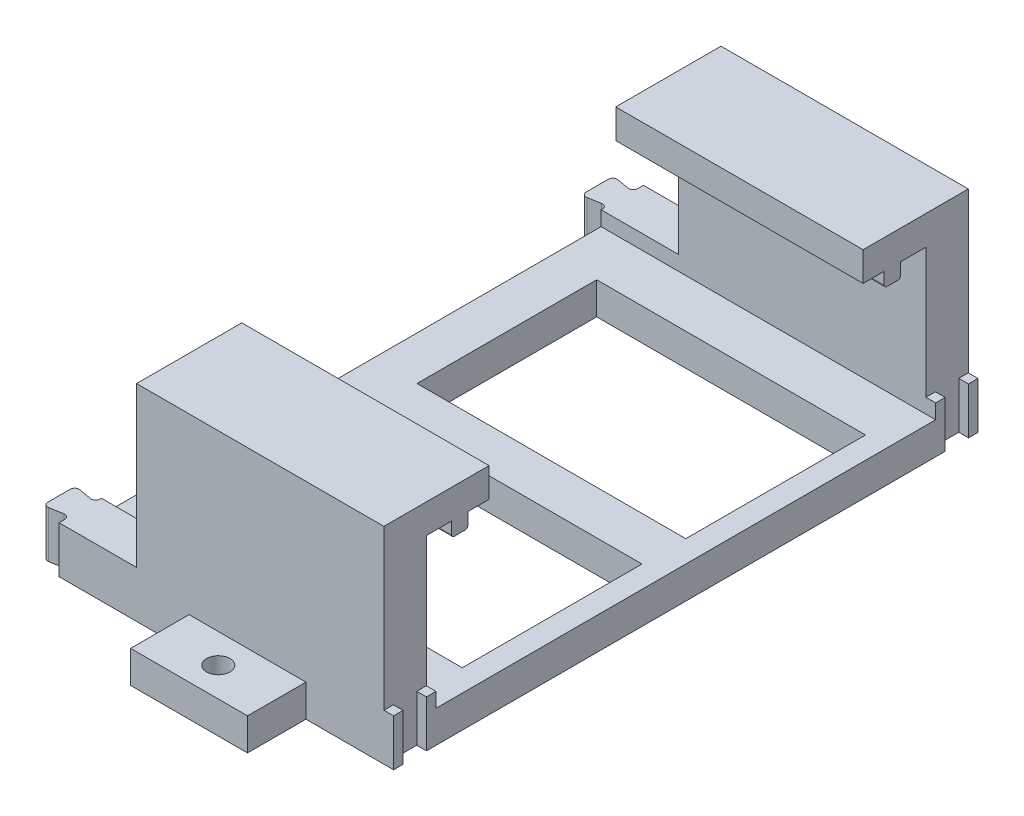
SolidWorks part; units mm, degrees
ref_plane "Front Plane" through (0, 0, 0) normal (0, 0, 1) x (1, 0, 0)
ref_plane "Top Plane" through (0, 0, 0) normal (0, 1, 0) x (1, 0, 0)
ref_plane "Right Plane" through (0, 0, 0) normal (1, 0, 0) x (0, 0, -1)
sketch "Sketch1" plane through (0, 0, 0) normal (0, 1, 0) x (1, 0, 0)
  line L1 (-184.5, -100) -> (184.5, -100)
  line L2 (-184.5, -100) -> (-184.5, 100)
  line L3 (-184.5, 100) -> (184.5, 100)
  line L4 (184.5, -100) -> (184.5, 100)
  line L5 (-184.5, -100) -> (184.5, 100) construction
  line L6 (-184.5, 100) -> (184.5, -100) construction
  point P0 (0, 0)
  dimension "D1" = 200
  dimension "353" = 369
extrude "Boss-Extrude1" add sketch "Sketch1" along normal blind 16
sketch "Sketch2" plane through (0, 16, 0) normal (0, 1, 0) x (1, 0, 0)
  line L0 (-184.5, -100) -> (184.5, -100) construction
  line L1 (-184.5, -100) -> (-155.6166, -100)
  line L2 (-184.5, -100) -> (-184.5, -36.5)
  line L3 (-184.5, -36.5) -> (-169.5, -36.5)
  line L4 (-169.5, -84) -> (-169.5, -36.5)
  line L5 (-184.5, 100) -> (-155.6166, 100)
  line L6 (-184.5, 100) -> (-184.5, 36.5)
  line L7 (-184.5, 36.5) -> (-169.5, 36.5)
  line L8 (-169.5, 84) -> (-169.5, 36.5)
  line L9 (-155.6166, 100) -> (-119.5, 100)
  line L11 (-169.5, 84) -> (-119.5, 84)
  line L12 (-119.5, 100) -> (-119.5, 84)
  line L13 (-155.6166, -100) -> (-119.5, -100)
  line L15 (-169.5, -84) -> (-119.5, -84)
  line L16 (-119.5, -100) -> (-119.5, -84)
  line L17 (-44.5, -100) -> (84.5, -100)
  line L18 (-44.5, -100) -> (-44.5, -84)
  line L19 (-44.5, -84) -> (84.5, -84)
  line L20 (84.5, -100) -> (84.5, -84)
  line L22 (-44.5, 100) -> (84.5, 100)
  line L23 (-44.5, 100) -> (-44.5, 84)
  line L24 (-44.5, 84) -> (84.5, 84)
  line L25 (84.5, 100) -> (84.5, 84)
  line L26 (184.5, -100) -> (184.5, 100) construction
  line L27 (184.5, 100) -> (-184.5, 100) construction
  point P28 (84.5, -92)
  dimension "D1" = 65
  dimension "D2" = 15
  dimension "D3" = 65
  dimension "D4" = 15
  dimension "D5" = 16
  dimension "D6" = 50
  dimension "D7" = 50
  dimension "D8" = 16
  dimension "D9" = 75
  dimension "D10" = 100
extrude "Boss-Extrude2" add sketch "Sketch2" along normal blind 12
sketch "Sketch3" plane through (0, 16, 0) normal (0, 1, 0) x (1, 0, 0)
  line L0 (-119.5, -84) -> (-169.5, -84) construction
  line L1 (-169.5, 84) -> (172.5, 84)
  line L2 (-169.5, 84) -> (-169.5, -84)
  line L3 (-169.5, -84) -> (172.5, -84)
  line L4 (172.5, 84) -> (172.5, -84)
  dimension "D1" = 342
extrude "Cut-Extrude1" cut sketch "Sketch3" against normal blind 5
sketch "Sketch4" plane through (0, 0, -100) normal (0, 0, -1) x (-1, 0, 0)
  line L0 (-84.5, 28) -> (44.5, 28) construction
  line L1 (-69.5, 16) -> (30.5, 16)
  line L2 (-69.5, 16) -> (-69.5, 28)
  line L3 (-69.5, 28) -> (30.5, 28)
  line L4 (30.5, 16) -> (30.5, 28)
  line L5 (-69.5, 16) -> (30.5, 28) construction
  line L6 (-69.5, 28) -> (30.5, 16) construction
  line L8 (-84.5, 28) -> (-84.5, 16) construction
  point P0 (-19.5, 22)
  dimension "D1" = 100
  dimension "D2" = 15
extrude "Boss-Extrude3" add sketch "Sketch4" along normal blind 60
sketch "Sketch8" plane through (0, 28, 0) normal (0, 1, 0) x (1, 0, 0)
  line L0 (-184.5, 36.5) -> (-169.5, 36.5)
  line L1 (-169.5, 36.5) -> (-169.5, 84)
  line L2 (-169.5, 84) -> (-119.5, 84)
  line L3 (-119.5, 84) -> (-119.5, 100)
  line L4 (-119.5, 100) -> (-184.5, 100)
  line L5 (-184.5, 100) -> (-184.5, 36.5)
extrude "Boss-Extrude5" add sketch "Sketch8" along normal blind 42
sketch "Sketch9" plane through (0, 70, 0) normal (0, 1, 0) x (1, 0, 0)
  line L0 (-119.5, 84) -> (-119.5, 70)
  line L1 (-119.5, 70) -> (-155.5, 70)
  line L2 (-155.5, 70) -> (-155.5, 35)
  line L3 (-155.5, 35) -> (-169.5, 35)
  line L4 (-169.5, 36.5) -> (-169.5, 84) construction
  line L5 (-169.5, 84) -> (-169.5, -84) construction
  line L6 (172.5, 84) -> (-169.5, 84) construction
  dimension "D1" = 14
  dimension "D2" = 14
extrude "Extrude-Thin1" add sketch "Sketch9" against normal blind 7 thin
sketch "Sketch11" plane through (0, 70, 0) normal (0, 1, 0) x (1, 0, 0)
  line L1 (-184.5, 100) -> (-44.5, 100)
  line L2 (-184.5, 100) -> (-184.5, -100)
  line L3 (-184.5, -100) -> (-44.5, -100)
  line L4 (-44.5, 100) -> (-44.5, -100)
extrude "Cut-Extrude5" cut sketch "Sketch11" against normal through all
sketch "Sketch13" plane through (0, 28, 0) normal (0, 1, 0) x (1, 0, 0)
  line L0 (-44.5, 96.22) -> (-44.5, 87.78)
  line L1 (-44.5, 100) -> (-44.5, 84) construction
  line L2 (-44.5, 87.78) -> (-52.3, 86.4046)
  line L3 (-52.3, 86.4046) -> (-52.3, 97.5954)
  line L4 (-52.3, 97.5954) -> (-44.5, 96.22)
  line L5 (-44.5, -87.78) -> (-44.5, -96.22)
  line L6 (-44.5, -96.22) -> (-52.5, -97.6306)
  line L7 (-52.5, -97.6306) -> (-52.5, -86.3694)
  line L8 (-52.5, -86.3694) -> (-44.5, -87.78)
  line L9 (-44.5, -84) -> (-44.5, -100) construction
  dimension "D1" = 3.78
  dimension "D2" = 3.78
  dimension "D3" = 7.8
  dimension "D4" = 80
  dimension "D5" = 80
  dimension "D6" = 3.78
  dimension "D7" = 3.78
  dimension "D8" = 80
  dimension "D9" = 8
  dimension "D10" = 80
extrude "Boss-Extrude6" add sketch "Sketch13" against normal through all
fillet "Fillet1" radius 1.5 8 edges at (-44.5, 14, 87.78) (-52.5, 14, 86.3694) (-52.5, 14, 97.6306) (-44.5, 14, 96.22) (-44.5, 14, -96.22) (-44.5, 14, -87.78) (-52.3, 14, -86.4046) (-52.3, 14, -97.5954)
sketch "Sketch14" plane through (0, 0, 0) normal (0, 0, 1) x (1, 0, 0)
  line L0 (84.5, 16) -> (184.5, 16) construction
  line L1 (84.5, 28) -> (-67.1004, 28)
  line L2 (84.5, 28) -> (84.5, 16)
  line L3 (84.5, 16) -> (-67.1004, 16)
  line L4 (-67.1004, 28) -> (-67.1004, 16)
extrude "Cut-Extrude6" cut sketch "Sketch14" along normal through all and the other way through all
sketch "Sketch15" plane through (0, 16, 0) normal (0, 1, 0) x (1, 0, 0)
  line L0 (184.5, 100) -> (-44.5, 100) construction
  line L1 (-17.9669, 100) -> (79.8991, 100)
  line L2 (-17.9669, 100) -> (-17.9669, 84)
  line L3 (-17.9669, 84) -> (79.8991, 84)
  line L4 (79.8991, 100) -> (79.8991, 84)
  line L5 (172.5, 84) -> (-44.5, 84) construction
extrude "Boss-Extrude7" add sketch "Sketch15" along normal blind 62
sketch "Sketch16" plane through (0, 0, -84) normal (0, 0, 1) x (1, 0, 0)
  line L0 (79.8991, 78) -> (79.8991, 16) construction
  line L1 (-17.9669, 78) -> (79.8991, 78)
  line L2 (-17.9669, 78) -> (-17.9669, 60.5)
  line L3 (-17.9669, 60.5) -> (79.8991, 60.5)
  line L4 (79.8991, 78) -> (79.8991, 60.5)
  line L5 (172.5, 11) -> (-44.5, 11) construction
  dimension "D1" = 49.5
extrude "Boss-Extrude8" add sketch "Sketch16" along normal blind 20
sketch "Sketch17" plane through (0, 60.5, 0) normal (0, -1, 0) x (1, 0, 0)
  line L0 (-17.9669, -64) -> (-17.9669, -84) construction
  line L1 (-17.9669, -71.2) -> (79.8991, -71.2)
  line L2 (-17.9669, -71.2) -> (-17.9669, -76.85)
  line L3 (-17.9669, -76.85) -> (79.8991, -76.85)
  line L4 (79.8991, -71.2) -> (79.8991, -76.85)
  line L5 (79.8991, -64) -> (79.8991, -84) construction
  line L6 (-17.9669, -84) -> (79.8991, -84) construction
  dimension "D1" = 5.65
  dimension "D2" = 7.15
extrude "Boss-Extrude9" add sketch "Sketch17" along normal blind 5
fillet "Fillet3" radius 1 2 edges at (30.9661, 55.5, -76.85) (30.9661, 55.5, -71.2)
sketch "Sketch18" plane through (0, 16, 0) normal (0, 1, 0) x (1, 0, 0)
  line L0 (184.5, -100) -> (184.5, 100) construction
  line L1 (172.5, 84) -> (184.5, 84)
  line L2 (172.5, 84) -> (172.5, -84)
  line L3 (172.5, -84) -> (184.5, -84)
  line L4 (184.5, 84) -> (184.5, -84)
  line L5 (-44.5, -84) -> (172.5, -84) construction
extrude "Cut-Extrude7" cut sketch "Sketch18" against normal blind 5
sketch "Sketch19" plane through (0, 0, -100) normal (0, 0, -1) x (-1, 0, 0)
  line L1 (0, 0) -> (-40, 0)
  line L2 (0, 0) -> (0, 11)
  line L3 (0, 11) -> (-40, 11)
  line L4 (-40, 0) -> (-40, 11)
  line L5 (-184.5, 0) -> (-144.5, 0)
  line L6 (-184.5, 0) -> (-184.5, 11)
  line L7 (-184.5, 11) -> (-144.5, 11)
  line L8 (-144.5, 0) -> (-144.5, 11)
  dimension "D1" = 11
  dimension "D2" = 11
  dimension "D3" = 40
  dimension "D4" = 40
extrude "Boss-Extrude10" add sketch "Sketch19" along normal blind 20
sketch "Sketch20" plane through (0, 11, 0) normal (0, 1, 0) x (1, 0, 0)
  line L0 (40, 120) -> (40, 100) construction
  line L1 (0, 120) -> (40, 120) construction
  line L2 (144.5, 120) -> (184.5, 120) construction
  line L3 (184.5, 120) -> (184.5, 100) construction
  circle A0 centre (164.5, 110) radius 4
  circle A1 centre (20, 110) radius 4
  dimension "D1" = 20
  dimension "D2" = 10
  dimension "D3" = 10
  dimension "D4" = 20
extrude "Cut-Extrude8" cut sketch "Sketch20" against normal through all
mirror "Mirror3" about plane through (0, 0, 0) normal (0, 0, 1) of "Cut-Extrude8", "Boss-Extrude10", "Boss-Extrude9", "Boss-Extrude7", "Boss-Extrude8", "Fillet3"
sketch "Sketch21" plane through (0, 11, 0) normal (0, 1, 0) x (1, 0, 0)
  line L1 (-29.5, 7.5) -> (62.5, 7.5)
  line L2 (-29.5, 7.5) -> (-29.5, 69)
  line L3 (-29.5, 69) -> (62.5, 69)
  line L4 (62.5, 7.5) -> (62.5, 69)
  line L5 (77.5, 69) -> (169.5, 69)
  line L6 (77.5, 69) -> (77.5, 7.5)
  line L7 (77.5, 7.5) -> (169.5, 7.5)
  line L8 (169.5, 69) -> (169.5, 7.5)
  line L9 (-44.5, -84) -> (-44.5, 84) construction
  line L10 (62.5, -7.5) -> (-29.5, -7.5)
  line L11 (62.5, -7.5) -> (62.5, -69)
  line L12 (62.5, -69) -> (-29.5, -69)
  line L13 (-29.5, -7.5) -> (-29.5, -69)
  line L14 (77.5, -7.5) -> (169.5, -7.5)
  line L15 (77.5, -7.5) -> (77.5, -69)
  line L16 (77.5, -69) -> (169.5, -69)
  line L17 (169.5, -7.5) -> (169.5, -69)
  line L18 (184.5, -84) -> (184.5, 84) construction
  line L19 (-44.5, -84) -> (184.5, -84) construction
  line L20 (184.5, 84) -> (79.8991, 84) construction
  line L21 (-17.9669, 84) -> (-44.5, 84) construction
  line L22 (-42.9, 0) -> (42.9, 0) construction
  dimension "D1" = 15
  dimension "D2" = 15
  dimension "D3" = 15
  dimension "D4" = 15
  dimension "D5" = 15
  dimension "D6" = 15
  dimension "D7" = 15
  dimension "D8" = 15
  dimension "D9" = 7.5
  dimension "D10" = 7.5
  dimension "D11" = 7.5
  dimension "D12" = 7.5
  dimension "D13" = 122
  dimension "D14" = 15
extrude "Cut-Extrude9" cut sketch "Sketch21" against normal through all
sketch "Sketch22" plane through (79.8991, 0, 0) normal (1, 0, 0) x (0, 0, -1)
  line L0 (-84, 11) -> (84, 11) construction
  line L1 (-84, 60.5) -> (-85.5, 60.5)
  line L2 (-84, 60.5) -> (-84, 11)
  line L3 (-84, 11) -> (-85.5, 11)
  line L4 (-85.5, 60.5) -> (-85.5, 11)
  dimension "D1" = 1.5
extrude "Cut-Extrude10" cut sketch "Sketch22" against normal through all both and the other way through all
mirror "Mirror4" about plane through (0, 0, 0) normal (0, 0, 1) of "Cut-Extrude10"
sketch "Sketch23" plane through (0, 78, 0) normal (0, 1, 0) x (1, 0, 0)
  line L0 (79.8991, -100) -> (-17.9669, -100) construction
  line L1 (79.8991, -64) -> (66.6759, -64)
  line L2 (79.8991, -64) -> (79.8991, -100)
  line L3 (79.8991, -100) -> (66.6759, -100)
  line L4 (66.6759, -64) -> (66.6759, -100)
extrude "Cut-Extrude11" cut sketch "Sketch23" against normal up to surface (62 mm away)
mirror "Mirror5" about plane through (0, 0, 0) normal (0, 0, 1) of "Cut-Extrude11"
sketch "Sketch25" plane through (0, 0, 0) normal (0, 1, 0) x (1, 0, 0)
  line L1 (184.5, -120) -> (70, -120)
  line L2 (184.5, -120) -> (184.5, 120)
  line L3 (184.5, 120) -> (70, 120)
  line L4 (70, -120) -> (70, 120)
  line L5 (77.5, 69) -> (77.5, 7.5) construction
  line L6 (144.5, 120) -> (184.5, 120) construction
  dimension "D1" = 7.5
extrude "Cut-Extrude12" cut sketch "Sketch25" along normal up to surface (16 mm away)
sketch "Sketch26" plane through (0, 0, -64) normal (0, 0, 1) x (1, 0, 0)
  line L0 (-17.9669, 78) -> (-17.9669, 16) construction
  line L1 (66.6759, 78) -> (-17.9669, 78)
  line L2 (66.6759, 78) -> (66.6759, 70.5)
  line L3 (66.6759, 70.5) -> (-17.9669, 70.5)
  line L4 (-17.9669, 78) -> (-17.9669, 70.5)
  line L5 (-17.9669, 60.5) -> (66.6759, 60.5) construction
  dimension "D1" = 10
extrude "Cut-Extrude13" cut sketch "Sketch26" against normal through all both and the other way through all
sketch "Sketch28" plane through (0, 16, 0) normal (0, 1, 0) x (1, 0, 0)
  line L0 (70, -100) -> (70, -85.5) construction
  line L1 (70, -88.75) -> (66.6759, -88.75)
  line L2 (70, -88.75) -> (70, -96.75)
  line L3 (70, -96.75) -> (66.6759, -96.75)
  line L4 (66.6759, -88.75) -> (66.6759, -96.75)
  line L5 (66.6759, -85.5) -> (66.6759, -100) construction
  line L6 (70, -85.5) -> (66.6759, -85.5) construction
  dimension "D1" = 8
  dimension "D2" = 3.25
extrude "Cut-Extrude14" cut sketch "Sketch28" against normal through all
mirror "Mirror6" about plane through (0, 0, 0) normal (0, 0, 1) of "Cut-Extrude14"
equation "\"´7.25\"=7.35"
